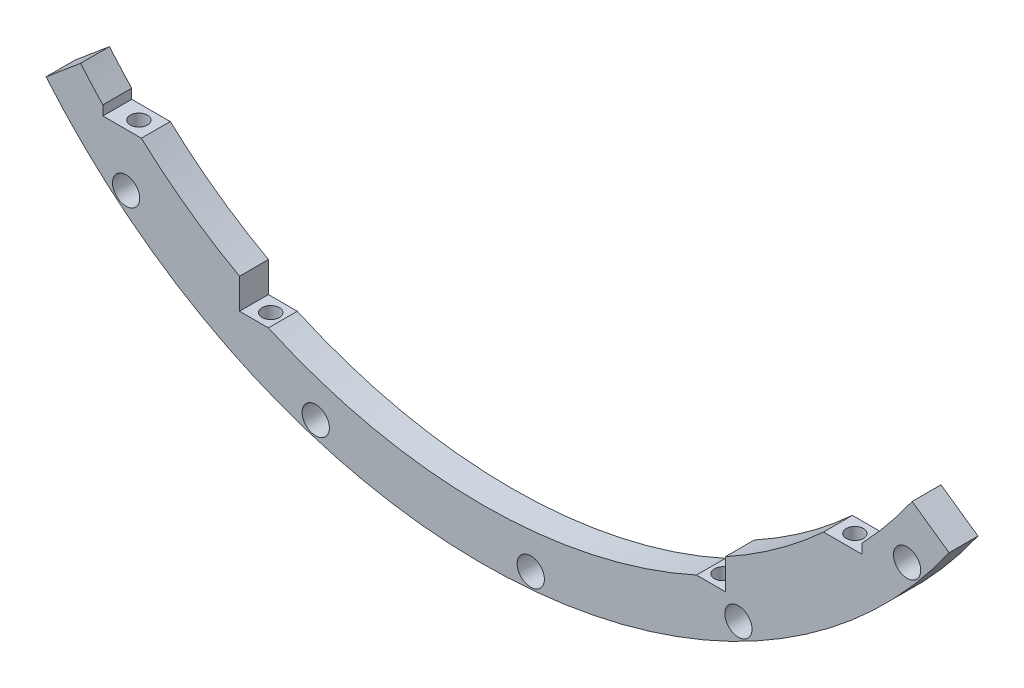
SolidWorks part; units mm, degrees
ref_plane "Front Plane" through (0, 0, 0) normal (0, 0, 1) x (1, 0, 0)
ref_plane "Top Plane" through (0, 0, 0) normal (0, 1, 0) x (1, 0, 0)
ref_plane "Right Plane" through (0, 0, 0) normal (1, 0, 0) x (0, 0, -1)
sketch "Sketch1" plane through (0, 0, 0) normal (0, 0, 1) x (1, 0, 0)
  line L0 (-27.4965, -87.2079) -> (0, 0) construction
  line L1 (0, 0) -> (42.2223, -81.1083) construction
  line L2 (0, 0) -> (0, -91.44) construction
  line L3 (-71.9929, -60.4092) -> (-66.2833, -55.6183)
  line L4 (76.9839, -53.9047) -> (70.8786, -49.6297)
  line L5 (-62.611, -61.3097) -> (-56.261, -61.3097)
  line L6 (-62.23, -59.4047) -> (62.23, -59.4047) construction
  line L7 (0, 0) -> (70.0471, -58.7765) construction
  line L8 (0, 0) -> (-58.7765, -70.0471) construction
  line L9 (-62.23, -59.4047) -> (-62.23, -60.9287) construction
  line L10 (-62.23, -60.9287) -> (62.23, -60.9287) construction
  line L11 (62.23, -59.4047) -> (62.23, -60.9287) construction
  line L12 (-62.611, -61.3097) -> (-62.611, -59.7222)
  line L13 (7.9695, -91.092) -> (0, 0) construction
  line L16 (62.611, -61.3097) -> (62.611, -59.7222)
  line L20 (-40.0685, -77.9329) -> (-35.306, -77.9329)
  line L21 (39.6875, -77.5519) -> (-39.6875, -77.5519) construction
  line L22 (39.6875, -77.5519) -> (39.6875, -76.0279) construction
  line L23 (39.6875, -76.0279) -> (-39.6875, -76.0279) construction
  line L24 (-39.6875, -77.5519) -> (-39.6875, -76.0279) construction
  line L25 (-40.0685, -77.9329) -> (-40.0685, -72.9294)
  line L29 (40.0685, -77.9329) -> (40.0685, -72.9294)
  line L35 (35.306, -77.9329) -> (40.0685, -77.9329)
  line L38 (56.261, -61.3097) -> (62.611, -61.3097)
  arc A0 (-71.9929, -60.4092) -> (76.9839, -53.9047) centre (0, 0) ccw
  arc A1 (33.7185, -80.8831) -> (-33.5345, -80.9596) centre (0, 0) ccw construction
  circle A2 centre (0, 0) radius 91.44 construction
  arc A3 (-40.0685, -72.9294) -> (-56.261, -61.3097) centre (0, 0) cw
  arc A4 (62.611, -59.7222) -> (70.8786, -49.6297) centre (0, 0) ccw
  arc A5 (40.0685, -72.9294) -> (56.261, -61.3097) centre (0, 0) ccw
  arc A6 (-35.306, -77.9329) -> (35.306, -77.9329) centre (0, 0) ccw
  arc A7 (-62.611, -59.7222) -> (-66.2833, -55.6183) centre (0, 0) cw
  point P15 (0, -59.4047)
  point P31 (0, -76.0279)
  dimension "D1" = 187.96
  dimension "D3" = 182.88
  dimension "D10" = 6.35
  dimension "D13" = 87.63
  dimension "D4" = 22.5
  dimension "D5" = 5
  dimension "D6" = 124.46
  dimension "D7" = 1.524
  dimension "D8" = 0.381
  dimension "D9" = 0.381
  dimension "D11" = 22.5
  dimension "D12" = 22.5
  dimension "D14" = 1.5875
  dimension "D15" = 10
  dimension "D16" = 79.375
  dimension "D17" = 1.524
  dimension "D18" = 0.381
  dimension "D19" = 0.381
  dimension "D20" = 5
  dimension "D21" = 22.5
  dimension "D23" = 4.7625
extrude "Extrude1" add sketch "Sketch1" along normal blind 4.7625
hole_wizard "#8 Clearance Hole1" positions "Sketch3" profile "Sketch4" hole size "#8" standard "Ansi Inch"
sketch "Sketch3" plane through (0, 0, 4.7625) normal (0, 0, 1) x (1, 0, 0)
  point P1 (7.9695, -91.092)
  point P4 (-27.4965, -87.2079)
  point P7 (-58.7765, -70.0471)
  point P10 (70.0471, -58.7765)
  point P13 (42.2223, -81.1083)
sketch "Sketch4" plane through (7.9695, -91.092, 4.7625) normal (1, 0, 0) x (0, -1, 0)
  line L0 (0, 0) -> (0, 4.7625)
  line L1 (0, 4.7625) -> (2.2479, 4.7625)
  line L2 (2.2479, 4.7625) -> (2.2479, 0)
  line L5 (2.2479, 0) -> (0, 0)
  line L11 (0, -6.35) -> (0, 107.95) construction
  dimension "Thru Hole Dia." = 4.4958
  dimension "Thru Hole Depth" = 4.7625
hole_wizard "#4-40 Tapped Hole1" positions "3DSketch1" profile "Sketch7" tap size "#4-40" standard "Ansi Inch"
sketch3d "3DSketch1"
  line L0 (35.306, -77.9329, 2.3813) -> (37.3062, -77.9329, 2.3812) construction
  line L4 (-37.3062, -77.9329, 2.3813) -> (-35.306, -77.9329, 2.3813) construction
  line L8 (35.306, -77.9329, 4.7625) -> (35.306, -77.9329, 0) construction
  line L9 (-35.306, -77.9329, 4.7625) -> (-35.306, -77.9329, 0) construction
  point P0 (37.3062, -77.9329, 2.3812)
  point P2 (-37.3062, -77.9329, 2.3813)
  dimension "D1" = 74.6125
sketch "Sketch7" plane through (37.3062, -77.9329, 2.3812) normal (1, 0, 0) x (0, 0, 1)
  line L0 (0, 0) -> (0, 8.3254)
  line L1 (0, 8.3254) -> (1.4224, 8.3254)
  line L2 (1.4224, 8.3254) -> (1.4224, 0)
  line L5 (1.4224, 0) -> (0, 0)
  line L11 (0, -6.35) -> (0, 107.95) construction
  dimension "Thread Major Dia." = 2.8448
  dimension "Thru Tap Drill Depth" = 8.3254
hole_wizard "#4-40 Tapped Hole2" positions "Sketch9" profile "Sketch8" tap size "#4-40" standard "Ansi Inch"
sketch "Sketch9" plane through (0, -61.3097, 0) normal (0, 1, 0) x (-1, 0, 0)
  line L0 (-56.261, 2.3813) -> (-59.055, 2.3813) construction
  line L1 (-56.261, 4.7625) -> (-56.261, 0) construction
  line L4 (56.261, 2.3813) -> (59.055, 2.3813) construction
  line L5 (56.261, 4.7625) -> (56.261, 0) construction
  point P0 (59.055, 2.3813)
  point P1 (-59.055, 2.3813)
  dimension "D1" = 118.11
sketch "Sketch8" plane through (-59.055, -61.3097, 2.3813) normal (1, 0, 0) x (0, 0, 1)
  line L0 (0, 0) -> (0, 9.5692)
  line L1 (0, 9.5692) -> (1.1303, 8.89)
  line L2 (1.1303, 8.89) -> (1.1303, 5.588)
  line L3 (1.1303, 5.588) -> (1.4224, 5.588)
  line L4 (1.4224, 5.588) -> (1.4224, 0)
  line L5 (1.4224, 0) -> (0, 0)
  line L10 (0, 9.5692) -> (-1.1303, 8.89) construction
  line L11 (0, -6.35) -> (0, 107.95) construction
  dimension "Tap Drill Dia." = 2.2606
  dimension "Tap Drill Depth" = 8.89
  dimension "Thread Major Dia." = 2.8448
  dimension "Thread Depth" = 5.588
  dimension "Drill Angle" = 118
